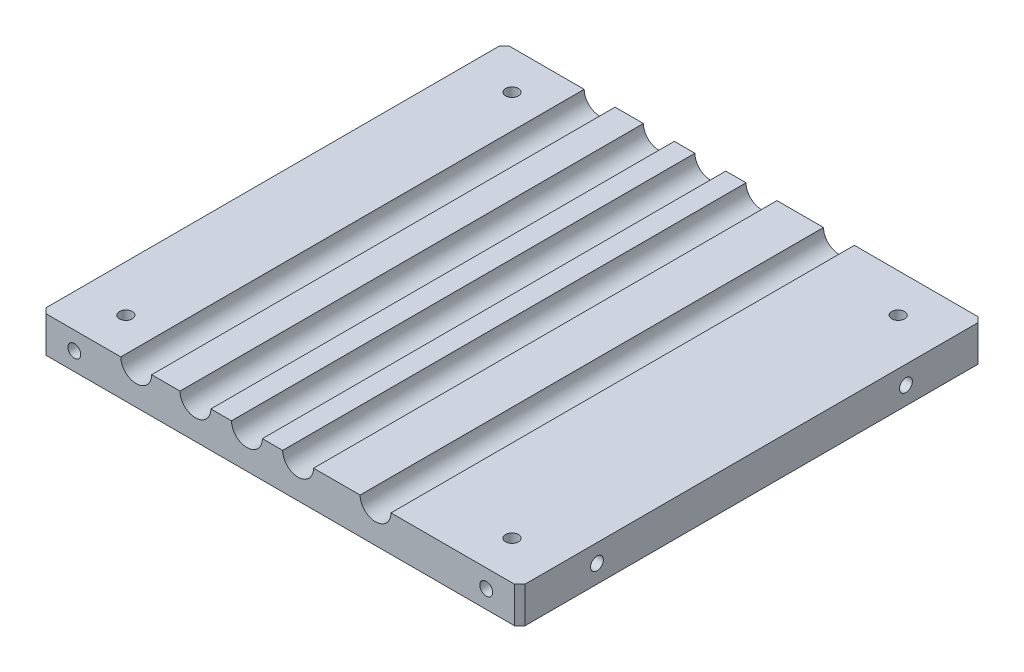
SolidWorks part; units mm, degrees
ref_plane "前视基准面" through (0, 0, 0) normal (0, 0, 1) x (1, 0, 0)
ref_plane "上视基准面" through (0, 0, 0) normal (0, 1, 0) x (1, 0, 0)
ref_plane "右视基准面" through (0, 0, 0) normal (1, 0, 0) x (0, 0, -1)
sketch "草图1" plane through (0, 0, 0) normal (0, 1, 0) x (1, 0, 0)
  line L1 (-46.5, 45) -> (46.5, 45)
  line L2 (-46.5, 45) -> (-46.5, -45)
  line L3 (-46.5, -45) -> (46.5, -45)
  line L4 (46.5, 45) -> (46.5, -45)
  line L5 (-46.5, 45) -> (46.5, -45) construction
  line L6 (-46.5, -45) -> (46.5, 45) construction
  point P0 (0, 0)
  dimension "D1" = 93
  dimension "D2" = 90
extrude "凸台-拉伸1" add sketch "草图1" along normal blind 7
chamfer "倒角1" distance 1 angle 45 4 edges at (46.5, 3.5, -45) (-46.5, 3.5, -45) (-46.5, 3.5, 45) (46.5, 3.5, 45)
sketch "草图2" plane through (0, 0, 45) normal (0, 0, 1) x (1, 0, 0)
  circle A0 centre (18.4939, 7) radius 3
  circle A1 centre (3.4597, 6.9833) radius 3
  circle A2 centre (-6.48, 7) radius 3
  circle A3 centre (-16.48, 7) radius 3
  circle A4 centre (-27.98, 7) radius 3
extrude "切除-拉伸1" cut sketch "草图2" against normal through all
hole_wizard "M3 螺纹孔1" positions "草图3" profile "草图4" tap size "M3" standard "GB"
sketch "草图3" plane through (0, 0, 0) normal (0, -1, 0) x (-1, 0, 0)
  point P0 (37.5, 37.5)
  point P3 (-37.5, 37.5)
  point P6 (-37.5, -37.5)
  point P9 (37.5, -37.5)
sketch "草图4" plane through (-37.5, 0, -37.5) normal (1, 0, 0) x (0, 0, -1)
  line L0 (0, 0) -> (0, 7)
  line L1 (0, 7) -> (1.25, 7)
  line L2 (1.25, 7) -> (1.25, 0)
  line L5 (1.25, 0) -> (0, 0)
  line L11 (0, -6.35) -> (0, 107.95) construction
  dimension "通孔螺纹孔钻头直径" = 2.5
  dimension "通孔螺纹孔钻头深度" = 7
hole_wizard "M3 螺纹孔2" positions "草图5" profile "草图6" tap size "M3" standard "GB"
sketch "草图5" plane through (46.5, 0, 0) normal (1, 0, 0) x (0, 0, -1)
  point P0 (30, 3.5)
  point P3 (-30, 3.5)
sketch "草图6" plane through (46.5, 3.5, -30) normal (0, 1, 0) x (0, 0, -1)
  line L0 (0, 0) -> (0, 8.2511)
  line L1 (0, 8.2511) -> (1.25, 7.5)
  line L2 (1.25, 7.5) -> (1.25, 0)
  line L5 (1.25, 0) -> (0, 0)
  line L10 (0, 8.2511) -> (-1.25, 7.5) construction
  line L11 (0, -6.35) -> (0, 107.95) construction
  dimension "螺纹孔钻头直径" = 2.5
  dimension "螺纹孔钻头深度" = 7.5
  dimension "导头角度" = 118
hole_wizard "M3 螺纹孔3" positions "草图7" profile "草图8" tap size "M3" standard "GB"
sketch "草图7" plane through (-46.5, 0, 0) normal (-1, 0, 0) x (0, 0, 1)
  point P0 (30, 3.5)
  point P3 (-30, 3.5)
sketch "草图8" plane through (-46.5, 3.5, 30) normal (0, 1, 0) x (0, 0, 1)
  line L0 (0, 0) -> (0, 8.2511)
  line L1 (0, 8.2511) -> (1.25, 7.5)
  line L2 (1.25, 7.5) -> (1.25, 0)
  line L5 (1.25, 0) -> (0, 0)
  line L10 (0, 8.2511) -> (-1.25, 7.5) construction
  line L11 (0, -6.35) -> (0, 107.95) construction
  dimension "螺纹孔钻头直径" = 2.5
  dimension "螺纹孔钻头深度" = 7.5
  dimension "导头角度" = 118
hole_wizard "M3 螺纹孔5" positions "草图11" profile "草图12" tap size "M3" standard "GB"
sketch "草图11" plane through (0, 0, -45) normal (0, 0, -1) x (-1, 0, 0)
  point P0 (40, 3.5)
  point P3 (-40, 3.5)
sketch "草图12" plane through (-40, 3.5, -45) normal (1, 0, 0) x (0, 1, 0)
  line L0 (0, 0) -> (0, 5.7511)
  line L1 (0, 5.7511) -> (1.25, 5)
  line L2 (1.25, 5) -> (1.25, 0)
  line L5 (1.25, 0) -> (0, 0)
  line L10 (0, 5.7511) -> (-1.25, 5) construction
  line L11 (0, -6.35) -> (0, 107.95) construction
  dimension "螺纹孔钻头直径" = 2.5
  dimension "螺纹孔钻头深度" = 5
  dimension "导头角度" = 118
hole_wizard "M3 螺纹孔6" positions "草图13" profile "草图14" tap size "M3" standard "GB"
sketch "草图13" plane through (0, 0, 45) normal (0, 0, 1) x (1, 0, 0)
  point P0 (40, 3.5)
  point P3 (-40, 3.5)
sketch "草图14" plane through (40, 3.5, 45) normal (1, 0, 0) x (0, -1, 0)
  line L0 (0, 0) -> (0, 6.7511)
  line L1 (0, 6.7511) -> (1.25, 6)
  line L2 (1.25, 6) -> (1.25, 0)
  line L5 (1.25, 0) -> (0, 0)
  line L10 (0, 6.7511) -> (-1.25, 6) construction
  line L11 (0, -6.35) -> (0, 107.95) construction
  dimension "螺纹孔钻头直径" = 2.5
  dimension "螺纹孔钻头深度" = 6
  dimension "导头角度" = 118
